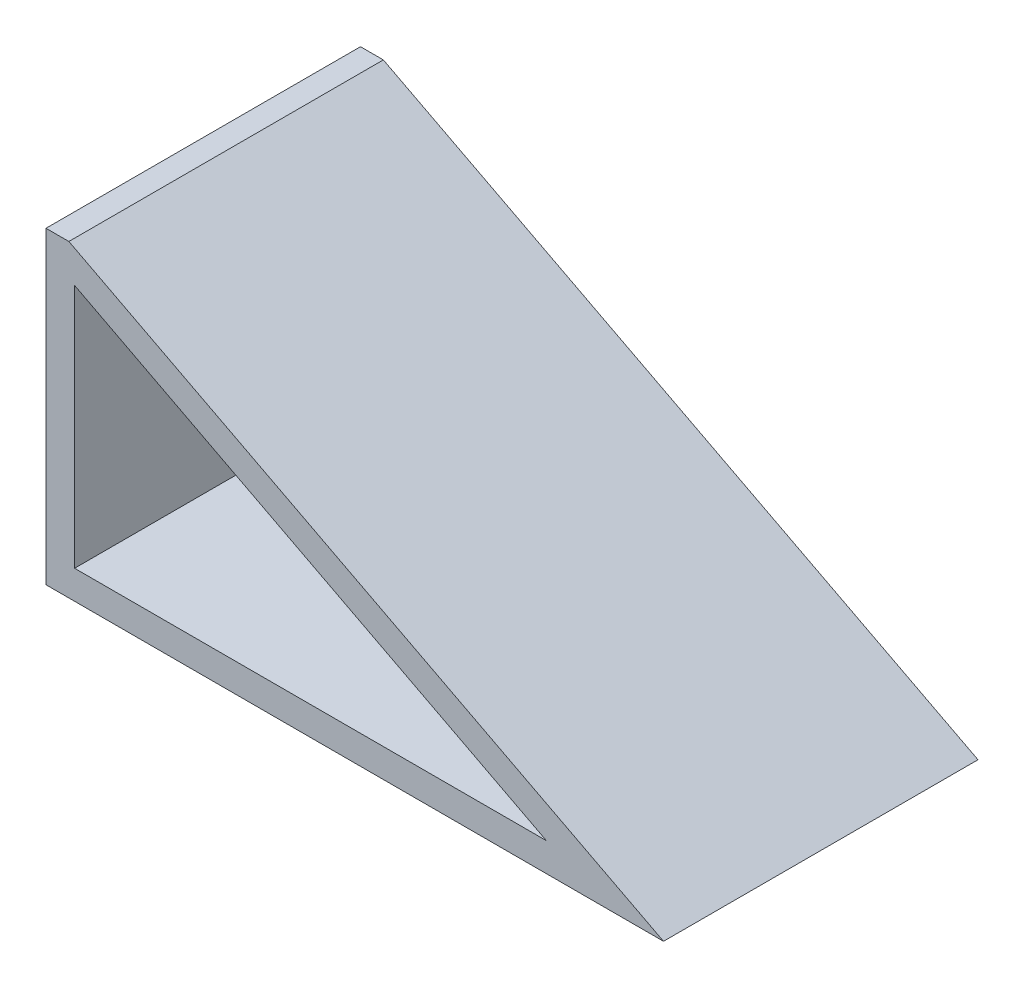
SolidWorks part; units mm, degrees
ref_plane "Front Plane" through (0, 0, 0) normal (0, 0, 1) x (1, 0, 0)
ref_plane "Top Plane" through (0, 0, 0) normal (0, 1, 0) x (1, 0, 0)
ref_plane "Right Plane" through (0, 0, 0) normal (1, 0, 0) x (0, 0, -1)
sketch "Sketch1" plane through (0, 0, 0) normal (0, 0, 1) x (1, 0, 0)
  line L1 (0, 0) -> (0, 68.58)
  line L2 (5.08, 68.58) -> (0, 68.58)
  line L3 (5.08, 68.58) -> (137.16, 0)
  line L4 (137.16, 0) -> (0, 0)
  dimension "D1" = 68.58
  dimension "D2" = 5.08
  dimension "D4" = 137.16
extrude "Boss-Extrude1" add sketch "Sketch1" along normal mid plane 69.85
shell "Shell1" thickness 6.35
sketch "Sketch2" plane through (0, 0, 0) normal (-1, 0, 0) x (0, 0, 1)
  line L0 (-34.925, 31.75) -> (-17.4625, 31.75) construction
  line L1 (-34.925, 68.58) -> (-34.925, 0) construction
  line L2 (-17.4625, 31.75) -> (17.4625, 31.75) construction
  line L3 (17.4625, 31.75) -> (34.925, 31.75) construction
  line L4 (34.925, 68.58) -> (34.925, 0) construction
  line L5 (34.925, 0) -> (-34.925, 0) construction
  circle A0 centre (-17.4625, 31.75) radius 4.064
  circle A1 centre (17.4625, 31.75) radius 4.064
  dimension "D1" = 8.128
  dimension "D2" = 31.75
  dimension "D3" = 34.925
extrude "Cut-Extrude1" cut sketch "Sketch2" against normal blind 3.048
